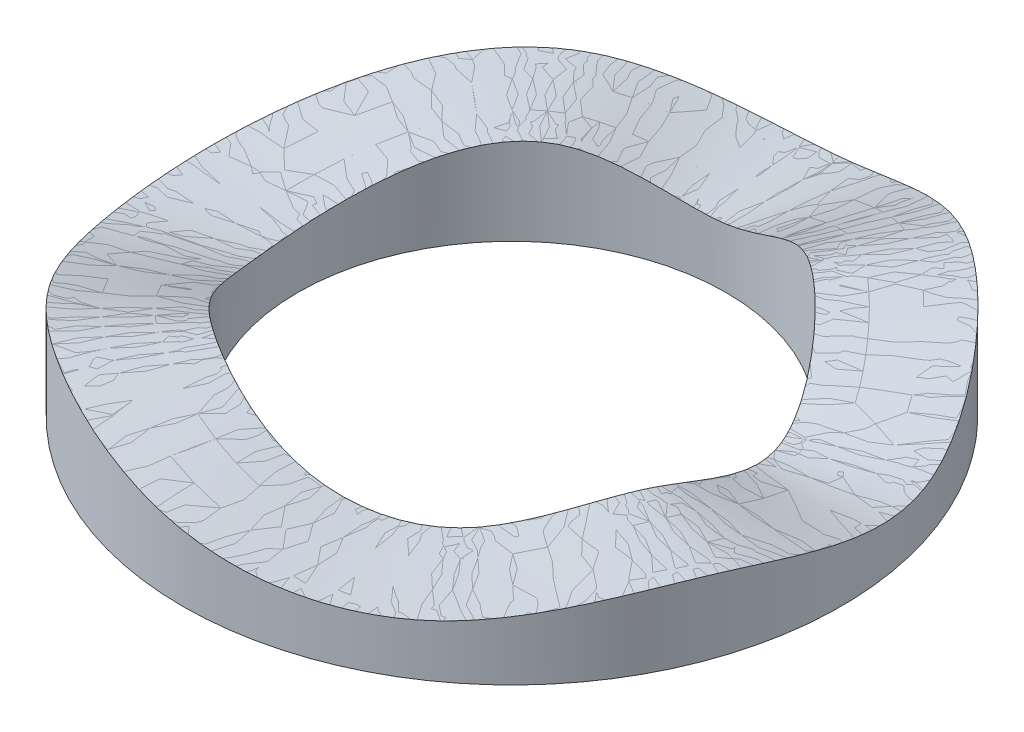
SolidWorks part; units mm, degrees
ref_plane "Ebene vorne" through (0, 0, 0) normal (0, 0, 1) x (1, 0, 0)
ref_plane "Ebene oben" through (0, 0, 0) normal (0, 1, 0) x (1, 0, 0)
ref_plane "Ebene rechts" through (0, 0, 0) normal (1, 0, 0) x (0, 0, -1)
sketch "Skizze1" plane through (0, 0, 0) normal (0, 1, 0) x (1, 0, 0)
  circle A0 centre (0, 0) radius 50
  circle A1 centre (0, 0) radius 32.5
  dimension "D1" = 100
  dimension "D2" = 65
extrude "Linear austragen1" add sketch "Skizze1" along normal blind 20
sketch "Skizze2" plane through (0, 20, 0) normal (0, 1, 0) x (1, 0, 0)
  line L0 (0, 0) -> (0, -50) construction
  line L1 (0, 0) -> (-29.3893, -40.4508) construction
  line L2 (0, 0) -> (-47.5528, -15.4508) construction
  line L3 (0, 0) -> (-47.5528, 15.4508) construction
  line L4 (0, 0) -> (-29.3893, 40.4508) construction
  line L5 (0, 0) -> (0, 50) construction
  line L6 (0, 0) -> (29.3893, 40.4508) construction
  line L7 (0, 0) -> (47.5528, 15.4508) construction
  line L8 (0, 0) -> (47.5528, -15.4508) construction
  line L9 (0, 0) -> (29.3893, -40.4508) construction
  circle A0 centre (0, 0) radius 50 construction
sketch3d "3D-Skizze1"
  spline S0 degree 3 poles (-31.4452, 18.6778, 43.0757) (-0.2043, 8.8385, 53.4326) (31.4376, 6.1421, 43.1658) (50.853, 14.6306, 16.5023) (50.5619, 1.1765, -17.1112) (31.5931, 22.8305, -42.9231) (0.2976, 3.7946, -53.4524) (-31.3557, 16.1997, -43.2221) (-50.7913, 9.3238, -16.6139) (-50.6782, 6.5436, 16.8503) (-31.4452, 18.6778, 43.0757) (-0.2043, 8.8385, 53.4326) (31.4376, 6.1421, 43.1658) knots -0.29941 -0.200615 -0.100028 0 0.09895 0.198157 0.297725 0.40057 0.501816 0.601383 0.70059 0.799385 0.899972 1 1.09895 1.198157 1.297725 only from (0, 10, 50) to (0, 10, 50)
  point P0 (0, 10, 50)
  point P1 (29.3893, 8, 40.4508)
  point P2 (47.5528, 11, 15.4508)
  point P5 (47.5528, 7, -15.4508)
  point P6 (29.3893, 16, -40.4508)
  point P7 (0, 9, -50)
  point P8 (-29.3893, 13, -40.4508)
  point P9 (-47.5528, 10, -15.4508)
  point P10 (-47.5528, 9, 15.4508)
  point P11 (-29.3893, 15, 40.4508)
  dimension "D1" = 10
  dimension "D2" = 15
  dimension "D3" = 8
  dimension "D4" = 11
  dimension "D5" = 7
  dimension "D6" = 16
  dimension "D7" = 9
  dimension "D8" = 13
  dimension "D9" = 10
  dimension "D10" = 9
sketch3d "3D-Skizze2"
  line L1 (0, 20, 0) -> (-29.3893, 20, -40.4508) construction
  line L2 (-19.103, 20, -26.2931) -> (-19.103, 0, -26.2931) construction
  line L3 (0, 20, -32.5) -> (0, 0, -32.5) construction
  line L4 (0, 20, 0) -> (0, 20, -50) construction
  line L6 (19.103, 20, -26.2931) -> (19.103, 0, -26.2931) construction
  line L7 (0, 20, 0) -> (29.3893, 20, -40.4508) construction
  line L10 (30.9093, 20, -10.0431) -> (30.9093, 0, -10.0431) construction
  line L11 (0, 20, 0) -> (47.5528, 20, -15.4508) construction
  line L12 (30.9093, 20, 10.0431) -> (30.9093, 0, 10.0431) construction
  line L13 (0, 20, 0) -> (47.5528, 20, 15.4508) construction
  line L14 (19.103, 20, 26.2931) -> (19.103, 0, 26.2931) construction
  line L15 (0, 20, 0) -> (29.3893, 20, 40.4508) construction
  line L16 (0, 20, 32.5) -> (0, 0, 32.5) construction
  line L17 (0, 20, 0) -> (0, 20, 50) construction
  line L18 (-19.103, 20, 26.2931) -> (-19.103, 0, 26.2931) construction
  line L19 (0, 20, 0) -> (-29.3893, 20, 40.4508) construction
  line L20 (-30.9093, 20, 10.0431) -> (-30.9093, 0, 10.0431) construction
  line L21 (0, 20, 0) -> (-47.5528, 20, 15.4508) construction
  line L22 (-30.9093, 20, -10.0431) -> (-30.9093, 0, -10.0431) construction
  line L23 (0, 20, 0) -> (-47.5528, 20, -15.4508) construction
  circle A0 centre (0, 20, 0) radius 32.5 construction
  circle A1 centre (0, 0, 0) radius 32.5 construction
  spline S0 degree 3 poles (-33.0182, 9.3339, -10.8954) (-20.352, 16.1576, -28.1137) (0.44, 3.8495, -34.7837) (20.6899, 22.8978, -27.6816) (32.6928, 1.2209, -11.6079) (33.1049, 14.5673, 10.7184) (20.4799, 6.1573, 28.0297) (-0.309, 8.8902, 34.7587) (-20.4853, 18.682, 27.8927) (-32.8515, 6.5963, 11.2501) (-33.0182, 9.3339, -10.8954) (-20.352, 16.1576, -28.1137) (0.44, 3.8495, -34.7837) knots -0.296796 -0.195436 -0.098197 0 0.099026 0.201875 0.308298 0.407324 0.505521 0.603121 0.703204 0.804564 0.901803 1 1.099026 1.201875 1.308298 only from (-19.103, 13, -26.2931) to (-19.103, 13, -26.2931)
  point P0 (-19.103, 15, 26.2931)
  point P1 (-30.9093, 9, 10.0431)
  point P2 (-30.9093, 10, -10.0431)
  point P3 (-19.103, 13, -26.2931)
  point P4 (0, 9, -32.5)
  point P5 (19.103, 16, -26.2931)
  point P9 (0, 10, 32.5)
  point P10 (19.103, 8, 26.2931)
  point P14 (0, 52.5, 0)
  point P17 (0, 32.5, 0)
  point P54 (30.9093, 11, 10.0431)
  point P55 (30.9093, 7, -10.0431)
  dimension "D1" = 16
  dimension "D2" = 9
  dimension "D3" = 13
  dimension "D4" = 10
  dimension "D5" = 9
  dimension "D6" = 15
  dimension "D7" = 7
  dimension "D8" = 11
  dimension "D9" = 8
  dimension "D10" = 10
sketch "Skizze3" plane through (0, 0, 0) normal (1, 0, 0) x (0, 0, -1)
  line L0 (-50, 10) -> (-32.5, 10) construction
sketch "Skizze6" plane through (0, 0, 0) normal (0, 0, 1) x (1, 0, 0)
  line L0 (-49.9395, 8.3315) -> (-32.4292, 8.3629)
sketch "Skizze7" plane through (0, 0, 0) normal (0, 0, 1) x (1, 0, 0)
  line L1 (32.406, 8.3388) -> (49.9202, 8.2539)
sketch "Skizze8" plane through (0, 0, 0) normal (1, 0, 0) x (0, 0, -1)
  line L0 (-50, 10) -> (-32.5, 10)
sketch "Skizze9" plane through (0, 0, 0) normal (1, 0, 0) x (0, 0, -1)
  line L0 (50, 9) -> (32.5, 9)
surface "Oberfläche-Ausformung2"
sketch "Skizze5" plane through (0, 20, 0) normal (0, 1, 0) x (1, 0, 0)
  circle A0 centre (0, 0) radius 32.5 construction
  circle A1 centre (0, 0) radius 50
  circle A2 centre (0, 0) radius 50
  circle A3 centre (0, 0) radius 32.5
  dimension "D1" = 0
extrude "Schnitt-Linear austragen2" cut sketch "Skizze5" against normal up to surface (10 mm away)
